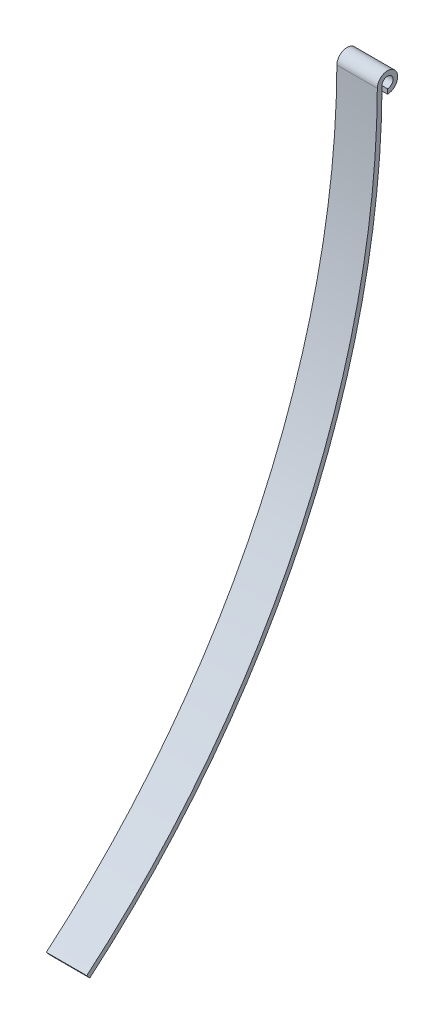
SolidWorks part; units mm, degrees
ref_plane "Face" through (0, 0, 0) normal (0, 0, 1) x (1, 0, 0)
ref_plane "Dessus" through (0, 0, 0) normal (0, 1, 0) x (1, 0, 0)
ref_plane "Droite" through (0, 0, 0) normal (1, 0, 0) x (0, 0, -1)
sketch "Esquisse1" plane through (0, 0, 0) normal (0, 0, 1) x (1, 0, 0)
  line L1 (0, 0) -> (25.8, 0)
  line L2 (0, 0) -> (0, 3)
  line L3 (0, 3) -> (25.8, 3)
  line L4 (25.8, 0) -> (25.8, 3)
  dimension "D1" = 25.8
  dimension "D2" = 3
sketch "Esquisse3" plane through (0, 0, 0) normal (1, 0, 0) x (0, 0, -1)
  line L0 (0, 6.5) -> (0, -59.5367) construction
  line L1 (0, 6.5) -> (-1387.9499, 6.5) construction
  line L2 (-529.4967, 8.3664) -> (-53.8152, -558.5287) construction
  line L3 (-529.4967, 8.3664) -> (150.0391, -308.5064) construction
  line L4 (-187.713, -396.0519) -> (-137.126, -353.6043) construction
  arc A0 (0, 0) -> (-6.5, 6.5) centre (0, 6.5) ccw
  arc A1 (-191.8912, -391.0726) -> (-6.5, 6.5) centre (-529.4967, 8.3664) ccw
  dimension "D1" = 13
  dimension "D3" = 523
  dimension "D2" = 90
  dimension "D4" = 50
  dimension "D5" = 25
sweep "Balayage2" add profiles "Esquisse1" path "Esquisse3"
